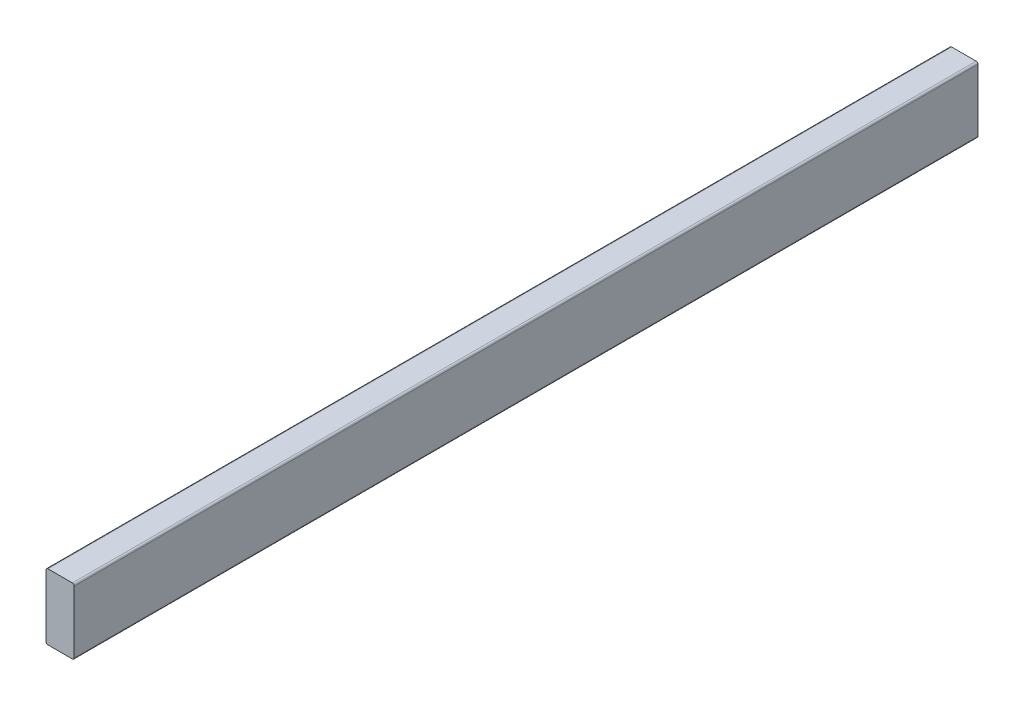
SolidWorks part; units mm, degrees
ref_plane "Front Plane" through (0, 0, 0) normal (0, 0, 1) x (1, 0, 0)
ref_plane "Top Plane" through (0, 0, 0) normal (0, 1, 0) x (1, 0, 0)
ref_plane "Right Plane" through (0, 0, 0) normal (1, 0, 0) x (0, 0, -1)
sketch "Sketch1" plane through (0, 0, 0) normal (0, 0, 1) x (1, 0, 0)
  line L1 (-19.05, -44.45) -> (19.05, -44.45)
  line L2 (-19.05, -44.45) -> (-19.05, 44.45)
  line L3 (-19.05, 44.45) -> (19.05, 44.45)
  line L4 (19.05, -44.45) -> (19.05, 44.45)
  line L5 (-19.05, -44.45) -> (19.05, 44.45) construction
  line L6 (-19.05, 44.45) -> (19.05, -44.45) construction
  point P0 (0, 0)
  dimension "D1" = 88.9
  dimension "D2" = 38.1
extrude "Boss-Extrude1" add sketch "Sketch1" along normal mid plane 1219.2
fillet "Fillet1" radius 2.54 4 edges at (-19.05, -44.45, 0) (19.05, -44.45, 0) (-19.05, 44.45, 0) (19.05, 44.45, 0)
